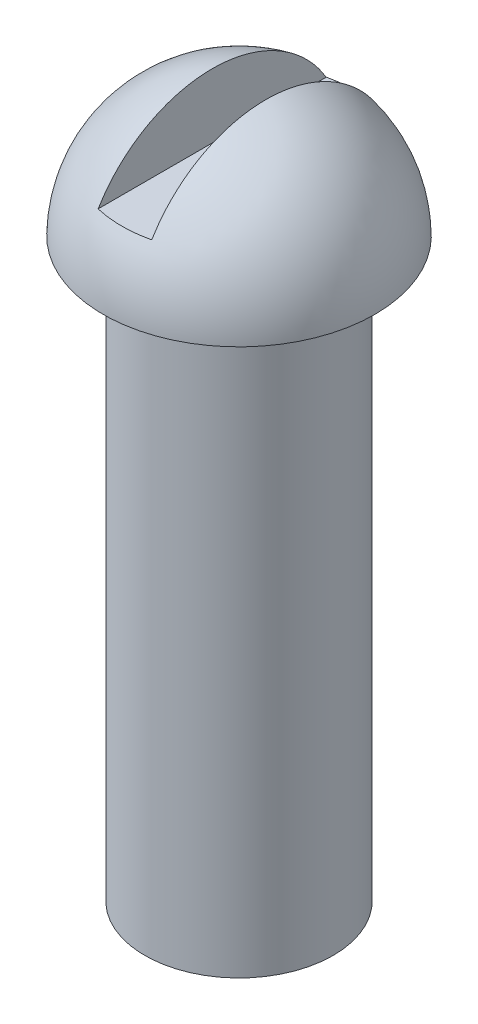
SolidWorks part; units mm, degrees
ref_plane "Front" through (0, 0, 0) normal (0, 0, 1) x (1, 0, 0)
ref_plane "Top" through (0, 0, 0) normal (0, 1, 0) x (1, 0, 0)
ref_plane "Right" through (0, 0, 0) normal (1, 0, 0) x (0, 0, -1)
sketch "Sketch1" plane through (0, 0, 0) normal (0, 0, 1) x (1, 0, 0)
  line L0 (0, 10.1105) -> (0, -21.844) construction
  line L1 (5.1562, 0) -> (3.5719, 0)
  line L2 (3.5719, 0) -> (3.5719, -21.844)
  line L3 (3.5719, -21.844) -> (0, -21.844)
  line L4 (0, -21.844) -> (0, 5.08)
  line L5 (0, 5.08) -> (-4.8734, 5.08) construction
  line L6 (50, 0) -> (-50, 0) construction
  arc A0 (0, 5.08) -> (5.1562, 0) centre (0, -0.0768) cw
  dimension "D1" = 10.3124
  dimension "D2" = 7.1437
  dimension "D3" = 26.924
  dimension "D4" = 5.08
revolve "Base-Revolve" add sketch "Sketch1" angle 360 about L0
sketch "Sketch2" plane through (0, 0, 0) normal (0, 0, 1) x (1, 0, 0)
  line L1 (-1.016, 4.9789) -> (-1.016, 2.54)
  line L2 (1.016, 2.54) -> (-1.016, 2.54)
  line L3 (1.016, 2.54) -> (1.016, 4.9789)
  line L5 (0, 2.9275) -> (0, -3.9159) construction
  line L6 (0, -21.844) -> (0, 0) construction
  arc A0 (5.1562, 0) -> (-5.1562, 0) centre (0, -0.0768) ccw construction
  arc A4 (1.016, 4.9789) -> (-1.016, 4.9789) centre (0, -0.0768) ccw
  dimension "D1" = 2.032
  dimension "D2" = 2.54
extrude "Cut-Extrude1" cut sketch "Sketch2" against normal through all and the other way through all
